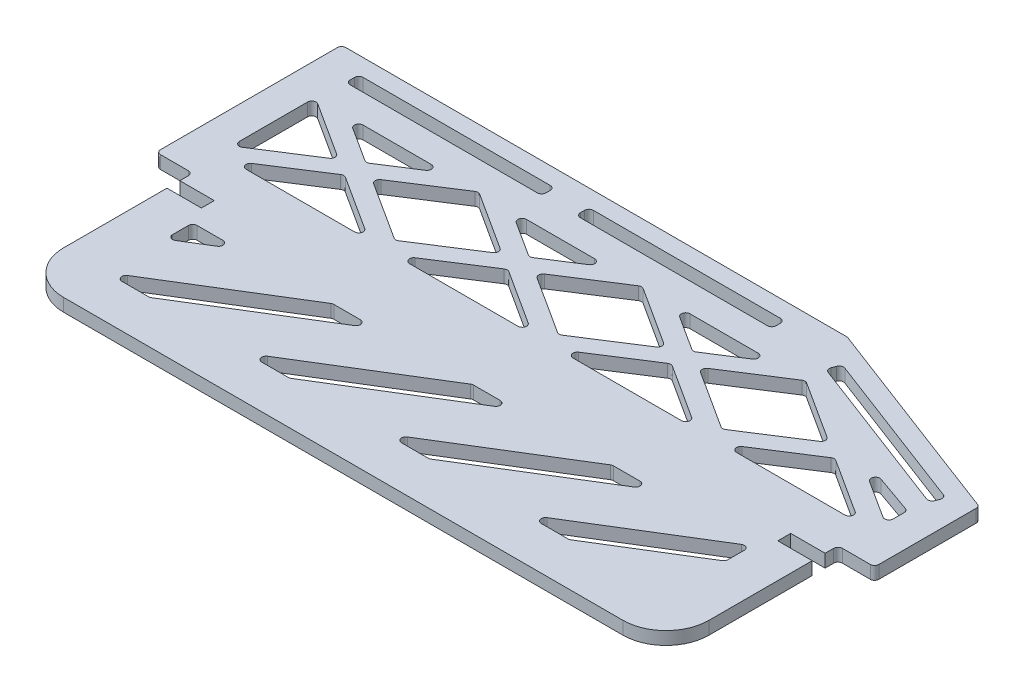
SolidWorks part; units mm, degrees
ref_plane "Front Plane" through (0, 0, 0) normal (0, 0, 1) x (1, 0, 0)
ref_plane "Top Plane" through (0, 0, 0) normal (0, 1, 0) x (1, 0, 0)
ref_plane "Right Plane" through (0, 0, 0) normal (1, 0, 0) x (0, 0, -1)
sketch "Sketch1" plane through (0, 0, 0) normal (0, 1, 0) x (1, 0, 0)
  line L0 (-80, 0) -> (70, 0) construction
  line L1 (70, -40) -> (-80, -40)
  line L2 (70, -40) -> (70, 0)
  line L3 (-88.5, 40) -> (-78.5, 40)
  line L4 (-80, -40) -> (-80, 0)
  line L5 (70, -40) -> (0, 0) construction
  line L6 (0, 0) -> (-80, -40) construction
  line L7 (-80, 0) -> (-88.5, 0)
  line L8 (-88.5, 0) -> (-88.5, 40)
  line L9 (70, 0) -> (78.5, 0)
  line L10 (78.5, 0) -> (78.5, 21)
  line L11 (-78.5, 40) -> (-78.5, 43.1)
  line L12 (-78.5, 43.1) -> (18.5, 43.1)
  line L13 (18.5, 43.1) -> (18.5, 40)
  line L14 (18.5, 40) -> (28.5, 40)
  line L15 (28.5, 40) -> (28.5, 16.1697) construction
  line L16 (67.2158, 21) -> (78.5, 21) construction
  line L17 (28.5, 40) -> (78.5, 21)
  point P0 (0, 0)
  dimension "D1" = 150
  dimension "D2" = 40
  dimension "D3" = 40
  dimension "D4" = 3.1
  dimension "D5" = 8.5
  dimension "D6" = 8.5
  dimension "D7" = 117
  dimension "D8" = 21
  dimension "D9" = 10
  dimension "D10" = 10
  dimension "D11" = 53.4883
extrude "Boss-Extrude1" add sketch "Sketch1" along normal blind 3
sketch "Sketch2" plane through (16.8782, 0, -44.4163) normal (0.3552, 0, -0.9348) x (-0.9348, 0, -0.3552)
  line L0 (-65.9209, 3) -> (-12.4326, 3) construction
  line L1 (-55.9209, 3) -> (-22.4326, 3)
  line L2 (-55.9209, 3) -> (-55.9209, 0)
  line L3 (-55.9209, 0) -> (-22.4326, 0)
  line L4 (-22.4326, 3) -> (-22.4326, 0)
  line L5 (-65.9209, 0) -> (-12.4326, 0) construction
  dimension "D1" = 10
  dimension "D2" = 10
extrude "Boss-Extrude2" add sketch "Sketch2" along normal blind 3.1
fillet "Fillet1" radius 10 2 edges at (70, 1.5, 40) (-80, 1.5, 40)
fillet "Fillet2" radius 1 15 edges at (69.1522, 1.5, -24.5522) (37.8478, 1.5, -36.4478) (18.5, 1.5, -40) (-78.5, 1.5, -40) (-80, 1.5, 0) (70, 1.5, 0) (70.2533, 1.5, -27.45) (28.5, 1.5, -40) (38.949, 1.5, -39.3457) (18.5, 1.5, -43.1) (-78.5, 1.5, -43.1) (78.5, 1.5, 0) (78.5, 1.5, -21) (-88.5, 1.5, -40) (-88.5, 1.5, 0)
sketch "Sketch3" plane through (0, 3, 0) normal (0, 1, 0) x (1, 0, 0)
  line L0 (-81, 0) -> (71, 0) construction
  line L1 (-37.5, -10) -> (-27.5, -10)
  line L2 (-37.5, -10) -> (-70, -10) construction
  line L3 (-70, -10) -> (-70, -30) construction
  line L4 (-70, -30) -> (-60, -30)
  line L5 (60, -10) -> (60, -16.1538)
  line L6 (-59.4593, -10) -> (-70, -16.4866)
  line L7 (-37.5, -30) -> (-27.5, -30)
  line L8 (-5, -10) -> (5, -10)
  line L9 (27.5, -10) -> (37.5, -10)
  line L10 (-5, -30) -> (5, -30)
  line L11 (27.5, -30) -> (37.5, -30)
  line L12 (-37.5, -10) -> (-70, -30)
  line L13 (-60, -30) -> (-27.5, -10)
  line L14 (-37.5, -30) -> (-5, -10)
  line L15 (-27.5, -30) -> (5, -10)
  line L16 (-5, -30) -> (27.5, -10)
  line L17 (5, -30) -> (37.5, -10)
  line L18 (27.5, -30) -> (60, -10)
  line L19 (37.5, -30) -> (60, -16.1538)
  line L20 (-70, -10) -> (-59.4593, -10)
  line L21 (-70, -10) -> (-70, -16.4866)
  line L22 (-81, 7) -> (-81, 32.5) construction
  line L23 (-81, 32.5) -> (-78, 32.5) construction
  line L24 (68, 7) -> (52, 17.2857)
  line L25 (36, 7) -> (68, 7)
  line L26 (-81, 7) -> (-5, 7) construction
  line L27 (-79.5, 40) -> (-87.5, 40) construction
  line L28 (71, 10) -> (71, 15.0964)
  line L29 (25.3333, 29.5) -> (2.6667, 29.5)
  line L30 (71, 10) -> (53.5078, 21.245)
  line L31 (-81, 19.75) -> (-78, 19.75) construction
  line L32 (-5, 7) -> (-5, 10) construction
  line L33 (-81, 7) -> (-43, 32.5) construction
  line L34 (52, 17.2857) -> (36, 7)
  line L35 (-43, 32.5) -> (-5, 7) construction
  line L36 (-43, 19.75) -> (-43, 32.5) construction
  line L37 (-43, 19.75) -> (-43, 7) construction
  line L38 (-5, 7) -> (-5, 10) construction
  line L39 (-5, 32.5) -> (-43, 7) construction
  line L40 (-43, 7) -> (-81, 32.5) construction
  line L42 (-81, 10) -> (-5, 10) construction
  line L43 (-78, 32.5) -> (-78, 7) construction
  line L44 (-46, 32.5) -> (-46, 7) construction
  line L45 (-40, 32.5) -> (-40, 7) construction
  line L46 (-8, 32.5) -> (-8, 7) construction
  line L47 (-81, 29.5) -> (-65.8333, 19.75)
  line L48 (-81, 10) -> (-65.8333, 19.75)
  line L49 (-78, 7) -> (-62, 17.2857)
  line L50 (-73.3333, 29.5) -> (-62, 22.2143)
  line L51 (-35.3333, 29.5) -> (-24, 22.2143)
  line L52 (-43, 29.5) -> (-27.8333, 19.75)
  line L53 (-12.6667, 29.5) -> (-24, 22.2143)
  line L54 (-5, 29.5) -> (-20.1667, 19.75)
  line L55 (-81, 29.5) -> (-81, 10)
  line L56 (-73.3333, 29.5) -> (-50.6667, 29.5) construction
  line L57 (-35.3333, 29.5) -> (-12.6667, 29.5) construction
  line L58 (48.1667, 19.75) -> (33, 10)
  line L59 (-8, 7) -> (-40, 7)
  line L60 (-46, 7) -> (-78, 7)
  line L61 (-62, 22.2143) -> (-50.6667, 29.5)
  line L62 (-58.1667, 19.75) -> (-43, 10)
  line L63 (-65.8333, 19.75) -> (-5, 19.75) construction
  line L64 (-62, 17.2857) -> (-46, 7)
  line L65 (-58.1667, 19.75) -> (-43, 29.5)
  line L66 (-20.1667, 19.75) -> (-5, 10)
  line L67 (-27.8333, 19.75) -> (-43, 10)
  line L68 (-24, 17.2857) -> (-8, 7)
  line L69 (-24, 17.2857) -> (-40, 7)
  line L70 (48.1667, 19.75) -> (33, 29.5)
  line L71 (17.8333, 19.75) -> (33, 10)
  line L72 (33, 29.5) -> (17.8333, 19.75)
  line L73 (-10.2522, 29.5) -> (-5, 29.5) construction
  line L74 (25.3333, 29.5) -> (14, 22.2143)
  line L75 (2.6667, 29.5) -> (14, 22.2143)
  line L76 (-2, 7) -> (30, 7)
  line L77 (14, 17.2857) -> (30, 7)
  line L78 (14, 17.2857) -> (-2, 7)
  line L79 (10.1667, 19.75) -> (-5, 10)
  line L80 (-5, 29.5) -> (-5, 32.5) construction
  line L81 (-5, 29.5) -> (-5, 32.5) construction
  line L82 (-5, 29.5) -> (10.1667, 19.75)
  line L83 (28.6716, 39.9348) -> (77.8552, 21.245) construction
  line L84 (71, 16.92) -> (75.799, 15.0964) construction
  line L85 (53.5078, 21.245) -> (71, 10) construction
  line L86 (71, 10) -> (71, 15.0964) construction
  line L87 (71, 15.0964) -> (53.5078, 21.245)
  line L88 (-12.6667, 29.5) -> (-35.3333, 29.5)
  line L89 (-8, 32.5) -> (-5, 32.5) construction
  line L90 (-50.6667, 29.5) -> (-73.3333, 29.5)
  line L91 (-46, 32.5) -> (-40, 32.5) construction
  dimension "D1" = 7.5
  dimension "D2" = 10
  dimension "D3" = 10
  dimension "D4" = 10
  dimension "D5" = 10
  dimension "D6" = 3
  dimension "D8" = 7
  dimension "D9" = 3
  dimension "D10" = 3
  dimension "D11" = 3
  dimension "D12" = 3
  dimension "D13" = 3
  dimension "D14" = 3
other "AlignGroup1"
extrude "Cut-Extrude1" cut sketch "Sketch3" against normal blind 10
sketch "Sketch5" plane through (0, 3, 0) normal (0, 1, 0) x (1, 0, 0)
  line L0 (-88.5, 39) -> (-88.5, 43.1)
  line L1 (-88.5, 43.1) -> (-77.5, 43.1)
  line L2 (-77.5, 43.1) -> (-77.5, 39)
  line L3 (-77.5, 39) -> (-88.5, 39)
  line L4 (17.5, 43.1) -> (29.0691, 43.1) construction
  line L5 (39.8838, 38.9904) -> (29.0691, 43.1) construction
  line L6 (17.5, 43.1) -> (29.0691, 43.1)
  line L7 (29.0691, 43.1) -> (39.8838, 38.9904)
  line L8 (39.8838, 38.9904) -> (38.199, 34.5569)
  line L9 (38.199, 34.5569) -> (17.5, 38.9904)
  line L10 (17.5, 38.9904) -> (17.5, 43.1)
  line L11 (69.3186, 27.8052) -> (78.5, 24.3163)
  line L12 (78.5, 24.3163) -> (78.5, 20.3102)
  line L13 (78.5, 20.3102) -> (67.6041, 24.4507)
  line L14 (67.6041, 24.4507) -> (69.3186, 27.8052)
extrude "Boss-Extrude3" add sketch "Sketch5" against normal up to surface (3 mm away)
sketch "Sketch6" plane through (0, 0, 0) normal (0, -1, 0) x (-1, 0, 0)
  line L0 (-72.8627, 22.1794) -> (-34.0691, 36.9209)
  line L1 (80.5, 36.1) -> (35, 36.1)
  line L2 (80.5, 36.1) -> (80.5, 39.1)
  line L3 (80.5, 39.1) -> (35, 39.1)
  line L4 (-18.5, 36.1) -> (-18.5, 39.1)
  line L5 (-78.5, 24.3163) -> (-29.0691, 43.1) construction
  line L6 (-71.797, 19.375) -> (-33.0035, 34.1166)
  line L7 (-72.8627, 22.1794) -> (-71.797, 19.375)
  line L8 (-34.0691, 36.9209) -> (-33.0035, 34.1166)
  line L10 (31, 39.1) -> (31, 37.1112) construction
  line L11 (27, 39.1) -> (27, 36.1)
  line L12 (35, 39.1) -> (35, 36.1)
  line L13 (27, 39.1) -> (-18.5, 39.1)
  line L14 (27, 36.1) -> (-18.5, 36.1)
  dimension "D1" = 99
  dimension "D2" = 8
  dimension "D3" = 41.5
  dimension "D4" = 5
  dimension "D5" = 4
  dimension "D6" = 4
  dimension "D7" = 4
  dimension "D8" = 4
  dimension "D9" = 3
  dimension "D10" = 3
extrude "Cut-Extrude2" cut sketch "Sketch6" against normal blind 10
fillet "Fillet5" radius 1 3 edges at (78.5, 1.5, -24.3163) (-88.5, 1.5, -43.1) (29.0691, 1.5, -43.1)
fillet "Fillet6" radius 1 12 edges at (-35, 1.5, -36.1) (-35, 1.5, -39.1) (-80.5, 1.5, -39.1) (-80.5, 1.5, -36.1) (-27, 1.5, -36.1) (-27, 1.5, -39.1) (34.0691, 1.5, -36.9209) (33.0035, 1.5, -34.1166) (71.797, 1.5, -19.375) (72.8627, 1.5, -22.1794) (18.5, 1.5, -36.1) (18.5, 1.5, -39.1)
fillet "Fillet7" radius 1 58 edges at (-27.5, 1.5, 30) (-37.5, 1.5, 30) (-5, 1.5, 10) (5, 1.5, 10) (-70, 1.5, 10) (-59.4593, 1.5, 10) (-70, 1.5, 16.4866) (36, 1.5, -7) (52, 1.5, -17.2857) (68, 1.5, -7) (48.1667, 1.5, -19.75) (33, 1.5, -10) (17.8333, 1.5, -19.75) (60, 1.5, 10) (60, 1.5, 16.1538) (37.5, 1.5, 30) (27.5, 1.5, 30) (2.6667, 1.5, -29.5) (25.3333, 1.5, -29.5) (14, 1.5, -22.2143) (27.5, 1.5, 10) (37.5, 1.5, 10) (5, 1.5, 30) (-5, 1.5, 30) (-37.5, 1.5, 10) (-27.5, 1.5, 10) (-60, 1.5, 30) (-70, 1.5, 30) (-81, 1.5, -29.5) (-65.8333, 1.5, -19.75) (-81, 1.5, -10) (10.1667, 1.5, -19.75) (-5, 1.5, -10) (-20.1667, 1.5, -19.75) (-5, 1.5, -29.5) (-78, 1.5, -7) (-62, 1.5, -17.2857) (-46, 1.5, -7) (-24, 1.5, -17.2857) (-8, 1.5, -7) (-40, 1.5, -7) (-43, 1.5, -29.5) (-27.8333, 1.5, -19.75) (-43, 1.5, -10) (-58.1667, 1.5, -19.75) (-62, 1.5, -22.2143) (-73.3333, 1.5, -29.5) (-50.6667, 1.5, -29.5) (14, 1.5, -17.2857) (30, 1.5, -7) (-2, 1.5, -7) (-24, 1.5, -22.2143) (-35.3333, 1.5, -29.5) (-12.6667, 1.5, -29.5) (71, 1.5, -15.0964) (71, 1.5, -10) (53.5078, 1.5, -21.245) (33, 1.5, -29.5)
sketch "Sketch7" plane through (0, 0, 0) normal (0, -1, 0) x (1, 0, 0)
  line L0 (71, 0) -> (-81, 0) construction
  line L1 (-80, 3) -> (70, 3) construction
  line L2 (-80, 1) -> (-80, 30) construction
  line L3 (70, 30) -> (70, 1) construction
  line L5 (70, 3) -> (62, 3)
  line L6 (70, 3) -> (70, 6)
  line L7 (70, 6) -> (62, 6)
  line L8 (62, 3) -> (62, 6)
  line L9 (-80, 3) -> (-72, 3)
  line L10 (-80, 3) -> (-80, 6)
  line L11 (-80, 6) -> (-72, 6)
  line L12 (-72, 3) -> (-72, 6)
  dimension "D1" = 3
  dimension "D2" = 8
  dimension "D3" = 3
  dimension "D4" = 8
  dimension "D5" = 3
extrude "Cut-Extrude3" cut sketch "Sketch7" against normal through all
